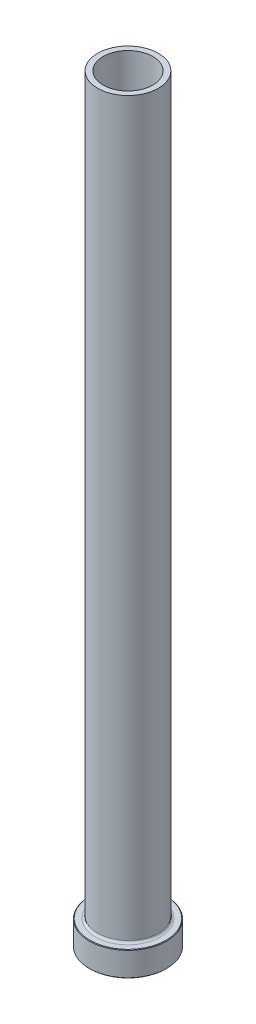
SolidWorks part; units mm, degrees
ref_plane "Front Plane" through (0, 0, 0) normal (0, 0, 1) x (1, 0, 0)
ref_plane "Top Plane" through (0, 0, 0) normal (0, 1, 0) x (1, 0, 0)
ref_plane "Right Plane" through (0, 0, 0) normal (1, 0, 0) x (0, 0, -1)
sketch "Sketch1" plane through (0, 0, 0) normal (0, 0, 1) x (1, 0, 0)
  line L0 (-9, 275) -> (-11, 275)
  line L1 (-11, 275) -> (-11, 9)
  line L2 (-11, 9) -> (-14, 9)
  line L3 (-14, 9) -> (-14, 0)
  line L4 (15.4, 0) -> (-15.4, 0) construction
  line L5 (-14, 0) -> (-9.25, 0)
  line L6 (-9, 220) -> (-9, 275)
  line L7 (0, 92.1877) -> (0, -15.5353) construction
  line L8 (0, -15.4) -> (0, 15.4) construction
  line L9 (-9, 220) -> (-9.25, 208)
  line L10 (-9.25, 208) -> (-9.25, 0)
  dimension "D1" = 0.25
  dimension "ID" = 18
  dimension "OD" = 22
  dimension "L" = 275
  dimension "H" = 28
  dimension "T" = 9
  dimension "N" = 55
  dimension "D2" = 12
revolve "Revolve1" add sketch "Sketch1" angle 360 about L7
fillet "Fillet1" radius 0.8 1 edges at (0, 9, 11)
chamfer "Chamfer1" distance 0.2 angle 45 2 edges at (0, 9, 14) (0, 0, 14)
chamfer "Chamfer3" distance 0.5 angle 45 1 edges at (0, 0, 9.25)
